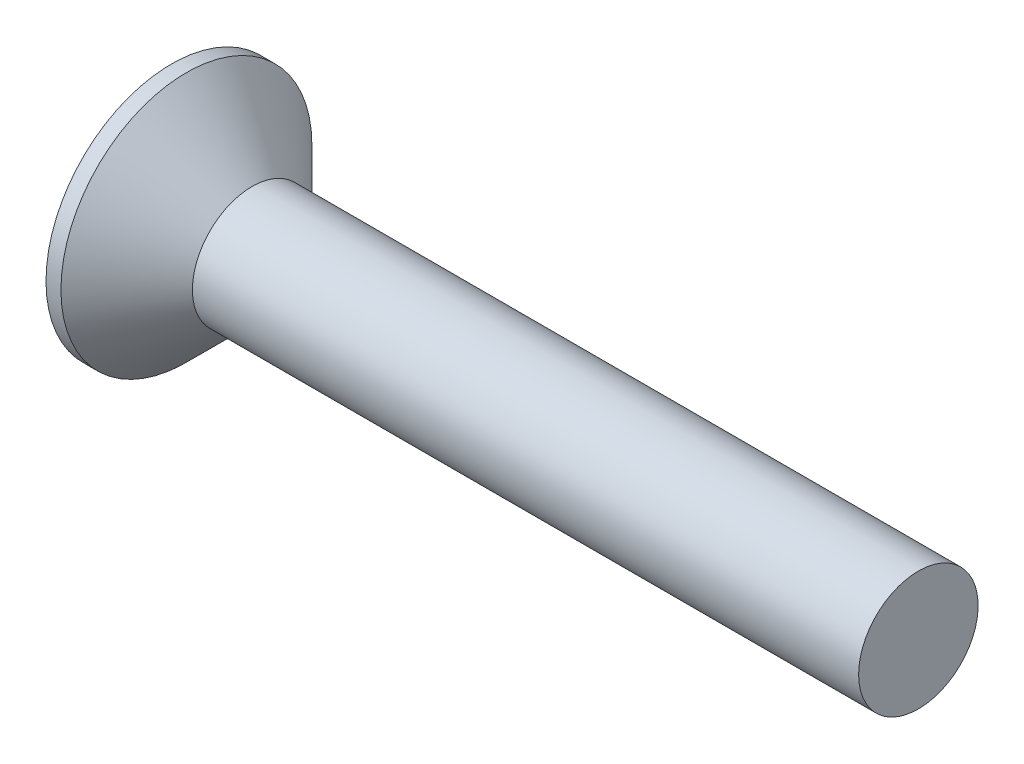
SolidWorks part; units mm, degrees
ref_plane "Plane1" through (0, 0, 0) normal (0, 0, 1) x (1, 0, 0)
ref_plane "Plane2" through (0, 0, 0) normal (0, 1, 0) x (1, 0, 0)
ref_plane "Plane3" through (0, 0, 0) normal (1, 0, 0) x (0, 0, -1)
revolve "Base-Revolve" add sketch "BodySke" angle 360 about L5
sketch "BodySke" plane through (0, 0, 0) normal (0, 0, 1) x (1, 0, 0)
  line L0 (0, 0) -> (0, 4.2)
  line L1 (0, 4.2) -> (0.5, 4.2)
  line L2 (2.7, 2) -> (25, 2)
  line L3 (25, 2) -> (25, 0)
  line L4 (25, 0) -> (0, 0)
  line L5 (-6.35, 0) -> (82.55, 0) construction
  line L6 (2.7, -2) -> (25, -2) construction
  line L7 (0.5, -4.2) -> (2.7, -2) construction
  line L8 (0.5, 4.2) -> (2.7, 2)
  line L9 (0, -4.2) -> (0.5, -4.2) construction
  line L10 (3.4, 3.5875) -> (3.4, -5.9375) construction
  line L11 (0, 6.35) -> (0, -3.175) construction
  dimension "Diameter" = 4
  dimension "Length" = 25
  dimension "Head_ht" = 2.7
  dimension "Head_dia" = 8.4
  dimension "Head_ang" = 90
  dimension "D6" = 0.5
  dimension "Advance" = 0.7
  dimension "Thread_nom" = 25
extrude "Slot" cut sketch "Sketch2" against normal blind 1.3
sketch "Sketch2" plane through (0, 0, 0) normal (-1, 0, 0) x (0, 0, 1)
  line L0 (-4.2, -0.75) -> (4.2, -0.75)
  line L1 (-4.2, -0.75) -> (-4.2, 0.75)
  line L2 (4.2, 0.75) -> (-4.2, 0.75)
  line L3 (4.2, 0.75) -> (4.2, -0.75)
  dimension "D1" = 0.75
  dimension "Slot_width" = 1.5
  dimension "D2" = 8.4
  dimension "D3" = 4.2
sketch "Sketch3" plane through (0, 0, 0) normal (-1, 0, 0) x (0, 0, 1)
  line L0 (-0.48, 2.23) -> (0.48, 2.23)
  line L1 (0.48, 2.23) -> (0.48, -2.23)
  line L2 (0.48, -2.23) -> (-0.48, -2.23)
  line L3 (-0.48, -2.23) -> (-0.48, 2.23)
  dimension "D1" = 2.23
  dimension "Cross_dia" = 4.46
  dimension "D2" = 0.48
  dimension "Cross_width" = 0.96
ref_plane "Plane4" through (2.65, 0, 0) normal (-1, 0, 0) x (0, 0, 1)
sketch "Sketch4" plane through (2.65, 0, 0) normal (-1, 0, 0) x (0, 0, 1)
  line L0 (-0.24, 0.24) -> (0.24, 0.24)
  line L3 (0.24, 0.24) -> (0.24, -0.24)
  line L4 (0.24, -0.24) -> (-0.24, -0.24)
  line L5 (-0.24, -0.24) -> (-0.24, 0.24)
  dimension "D1" = 0.48
  dimension "D2" = 0.48
  dimension "D3" = 0.24
  dimension "D4" = 0.24
loft "Cross" cut profiles "Sketch3", "Sketch4"
pattern_circular "CirPattern1" count 2 every 90 about axis through (0, 0, 0) along (1, 0, 0) of "Cross"
sketch "ThdSchSke" plane through (0, 0, 0) normal (0, 0, 1) x (1, 0, 0)
  line L0 (3.4, -1.61) -> (3.1269, -2)
  line L1 (3.4, -1.61) -> (3.6731, -2)
  line L2 (3.6731, -2) -> (3.6731, -2.5)
  line L3 (-3.175, 0) -> (5.1513, 0) construction
  line L5 (3.6731, -2.5) -> (3.1269, -2.5)
  line L6 (3.1269, -2.5) -> (3.1269, -2)
  line L7 (0, 4.2) -> (0, -4.2) construction
  dimension "Thread_minor" = 3.22
  dimension "Diameter" = 4
  dimension "Start" = 3.4
  dimension "SideAngle" = 55
  dimension "VeeAngle" = 70
  dimension "Overcut" = 5
revolve "ThreadSchematic" cut sketch "ThdSchSke" angle 360 about L3
pattern_linear "ThdSchPat"
equation "\"D1@Sketch3\" = \"Cross_dia@Sketch3\" / 2"
equation "\"D2@Sketch3\" = \"Cross_width@Sketch3\" / 2"
equation "\"D1@Sketch4\" = \"Cross_width@Sketch3\" *.5"
equation "\"D2@Sketch4\" = \"D1@Sketch4\""
equation "\"D4@Sketch4\" = \"D2@Sketch4\" / 2"
equation "\"D3@Sketch4\" = \"D1@Sketch4\" / 2"
equation "\"D1@Sketch2\" = \"Slot_width@Sketch2\" / 2"
equation "\"D2@Sketch2\" = \"Head_dia@BodySke\""
equation "\"D3@Sketch2\" = \"D2@Sketch2\" / 2"
equation "\"Thread_length@ThreadCosmetic\" = ((sgn( (\"Length@BodySke\" - \"Advance@BodySke\" - \"Head_ht@BodySke\" ) - \"Thread_nom@BodySke\" )-1)*( (\"Length@BodySke\" - \"Advance@BodySke\" - \"Head_ht@BodySke\" ) - \"Thread_"
equation "\"Thread_minor@ThdSchSke\" = \"Thread_minor@ThreadCosmetic\""
equation "\"Diameter@ThdSchSke\" = \"Diameter@BodySke\""
equation "\"Overcut@ThdSchSke\" = \"Diameter@BodySke\" * 1.25"
equation "\"Start@ThdSchSke\" = 0.000001 + \"Length@BodySke\" - \"Thread_length@ThreadCosmetic\"  '---Countersunk---"
equation "\"Num_threads@ThdSchPat\" = int( \"Thread_length@ThreadCosmetic\" / \"Advance@BodySke\" + 0.999 )  + 1"
equation "\"Advance@ThdSchPat\" = \"Thread_length@ThreadCosmetic\" /  (\"Num_threads@ThdSchPat\" - 1) 'relax it"
